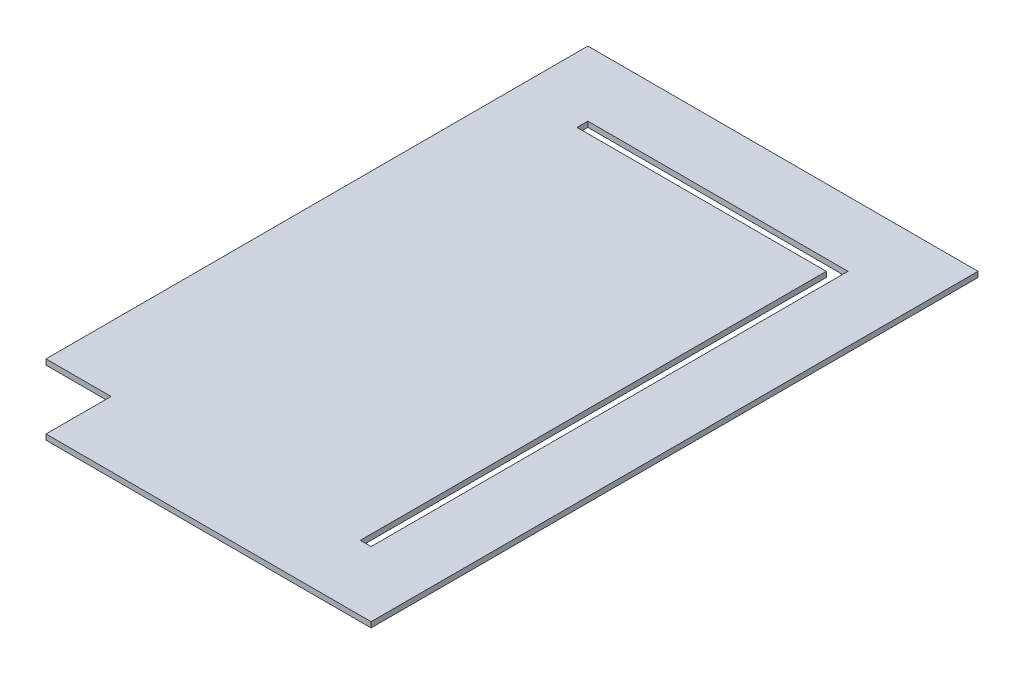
SolidWorks part; units mm, degrees
ref_plane "Front Plane" through (0, 0, 0) normal (0, 0, 1) x (1, 0, 0)
ref_plane "Top Plane" through (0, 0, 0) normal (0, 1, 0) x (1, 0, 0)
ref_plane "Right Plane" through (0, 0, 0) normal (1, 0, 0) x (0, 0, -1)
sketch "Sketch2" plane through (0, 0, 0) normal (0, 1, 0) x (1, 0, 0)
  line L1 (-114.3, -177.8) -> (114.3, -177.8)
  line L2 (-114.3, -177.8) -> (-114.3, 177.8)
  line L3 (-114.3, 177.8) -> (114.3, 177.8)
  line L4 (114.3, -177.8) -> (114.3, 177.8)
  line L5 (-114.3, -177.8) -> (114.3, 177.8) construction
  line L6 (-114.3, 177.8) -> (114.3, -177.8) construction
  point P0 (0, 0)
  dimension "D1" = 228.6
  dimension "D2" = 355.6
extrude "Boss-Extrude1" add sketch "Sketch2" along normal blind 3.175
sketch "Sketch3" plane through (0, 3.175, 0) normal (0, 1, 0) x (1, 0, 0)
  line L0 (-114.3, 177.8) -> (-114.3, -177.8) construction
  line L1 (-76.2, 139.7) -> (76.2, 139.7)
  line L2 (-76.2, 139.7) -> (-76.2, 133.35)
  line L3 (-76.2, 133.35) -> (76.2, 133.35)
  line L4 (76.2, 139.7) -> (76.2, 133.35)
  line L5 (76.2, 133.35) -> (69.85, 133.35)
  line L6 (76.2, 133.35) -> (76.2, -139.7)
  line L7 (76.2, -139.7) -> (69.85, -139.7)
  line L8 (69.85, 133.35) -> (69.85, -139.7)
  line L9 (114.3, 177.8) -> (-114.3, 177.8) construction
  line L10 (114.3, -177.8) -> (114.3, 177.8) construction
  line L11 (-114.3, -177.8) -> (114.3, -177.8) construction
  point P13 (73.025, -139.7)
  dimension "D1" = 6.35
  dimension "D2" = 6.35
  dimension "D3" = 38.1
  dimension "D4" = 38.1
  dimension "D5" = 38.1
  dimension "D6" = 38.1
extrude "Cut-Extrude1" cut sketch "Sketch3" against normal through all contours L2 L1 L4 L3 | L6 L5 L8 L7
sketch "Sketch4" plane through (0, 3.175, 0) normal (0, 1, 0) x (1, 0, 0)
  line L1 (-114.3, -177.8) -> (-76.2, -177.8)
  line L2 (-114.3, -177.8) -> (-114.3, -139.7)
  line L3 (-114.3, -139.7) -> (-76.2, -139.7)
  line L4 (-76.2, -177.8) -> (-76.2, -139.7)
  dimension "D1" = 38.1
  dimension "D2" = 38.1
extrude "Cut-Extrude2" cut sketch "Sketch4" against normal through all
